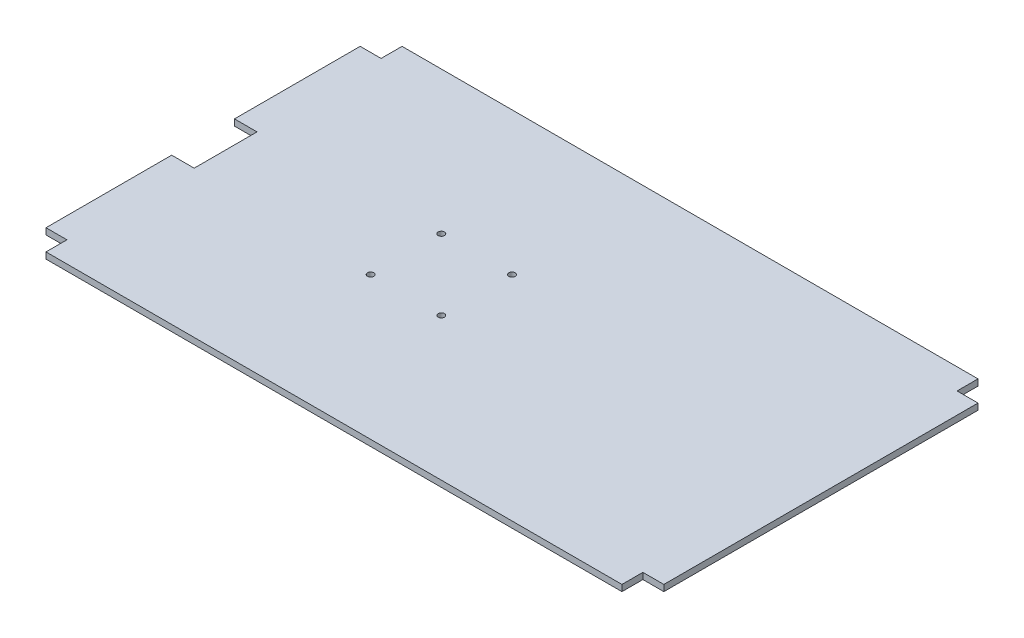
SolidWorks part; units mm, degrees
ref_plane "Front Plane" through (0, 0, 0) normal (0, 0, 1) x (1, 0, 0)
ref_plane "Top Plane" through (0, 0, 0) normal (0, 1, 0) x (1, 0, 0)
ref_plane "Right Plane" through (0, 0, 0) normal (1, 0, 0) x (0, 0, -1)
sketch "Sketch1" plane through (0, 0, 0) normal (0, 1, 0) x (1, 0, 0)
  line L0 (0, 340) -> (0, -340) construction
  line L5 (-550, -340) -> (550, -340)
  line L6 (-590, -300) -> (-590, 300)
  line L7 (-550, 340) -> (550, 340)
  line L8 (590, -300) -> (590, 300)
  line L9 (590, 0) -> (-590, 0) construction
  line L15 (590, -300) -> (550, -300)
  line L16 (550, -340) -> (550, -300)
  line L19 (-590, -300) -> (-550, -300)
  line L20 (-550, -340) -> (-550, -300)
  line L23 (-590, 300) -> (-550, 300)
  line L24 (-550, 340) -> (-550, 300)
  line L25 (590, 300) -> (550, 300)
  line L26 (550, 340) -> (550, 300)
  point P0 (0, 0)
  point P19 (0, -340)
  point P20 (0, 0)
  dimension "D1" = 40
  dimension "D2" = 40
  dimension "D3" = 1180
  dimension "D4" = 680
  dimension "D5" = 40
  dimension "D6" = 40
  dimension "D7" = 40
  dimension "D8" = 40
  dimension "D9" = 40
  dimension "D10" = 40
extrude "Boss-Extrude1" add sketch "Sketch1" along normal mid plane 12
sketch "Sketch2" plane through (0, 6, 0) normal (0, 1, 0) x (1, 0, 0)
  line L0 (-590, 300) -> (-590, -300) construction
  line L1 (-590, -60) -> (-547, -60)
  line L2 (-590, -60) -> (-590, 60)
  line L3 (-590, 60) -> (-547, 60)
  line L4 (-547, -60) -> (-547, 60)
  line L5 (-550, -340) -> (550, -340) construction
  line L6 (550, 340) -> (-550, 340) construction
  dimension "D1" = 280
  dimension "D2" = 280
  dimension "D3" = 43
extrude "Cut-Extrude1" cut sketch "Sketch2" against normal up to next
sketch "Sketch4" plane through (0, 6, 0) normal (0, 1, 0) x (1, 0, 0)
  circle A0 centre (-202.5, -67.5) radius 6
  circle A1 centre (-202.5, 67.5) radius 6
  circle A2 centre (-67.5, -67.5) radius 6
  circle A3 centre (-67.5, 67.5) radius 6
  dimension "D1" = 12
extrude "Cut-Extrude2" cut sketch "Sketch4" against normal up to next
